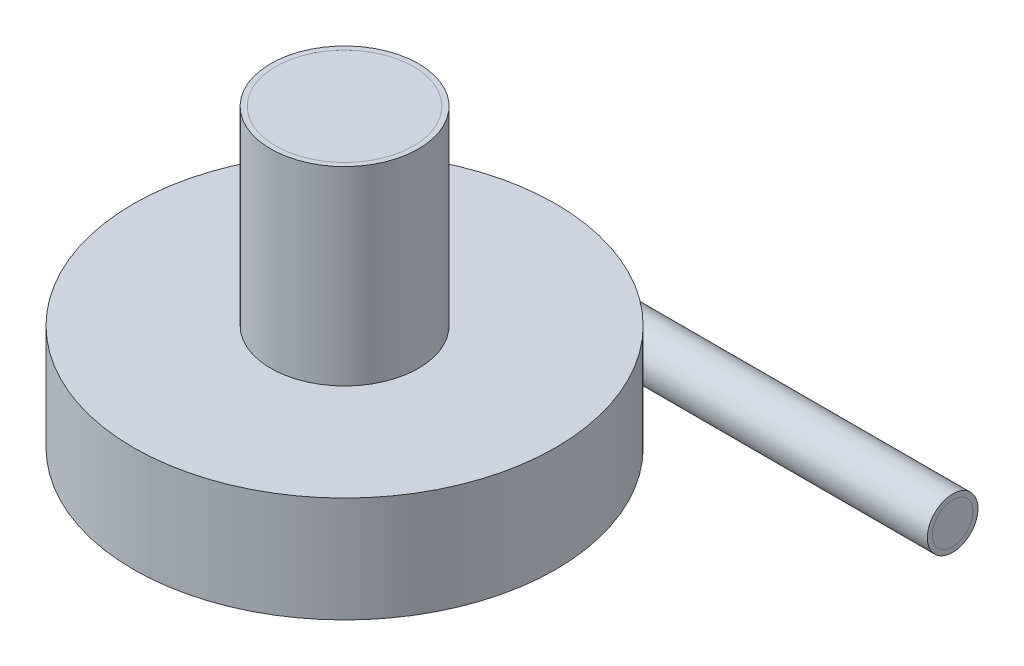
SolidWorks part; units mm, degrees
ref_plane "Front Plane" through (0, 0, 0) normal (0, 0, 1) x (1, 0, 0)
ref_plane "Top Plane" through (0, 0, 0) normal (0, 1, 0) x (1, 0, 0)
ref_plane "Right Plane" through (0, 0, 0) normal (1, 0, 0) x (0, 0, -1)
sketch "Sketch1" plane through (0, 0, 0) normal (0, 1, 0) x (1, 0, 0)
  line L0 (0, -40) -> (-4, -40)
  line L1 (-34.641, -20) -> (-36.641, -16.5359)
  line L2 (-34.641, 20) -> (-32.641, 23.4641)
  line L3 (0, 40) -> (4, 40)
  line L4 (34.641, 20) -> (36.641, 16.5359)
  line L5 (34.641, -20) -> (32.641, -23.4641)
  arc A0 (6.4713, -21.5493) -> (21.2246, -7.4678) centre (0, 0) ccw
  arc A1 (6.4713, -21.5493) -> (0, -40) centre (-13.2288, -25) cw
  arc A2 (4.145, -22.1149) -> (-4, -40) centre (-13.2288, -25) cw
  arc A3 (-17.0796, -14.6471) -> (-36.641, -16.5359) centre (-28.265, -1.0436) cw
  arc A4 (-15.4266, -16.379) -> (-34.641, -20) centre (-28.265, -1.0436) cw
  arc A5 (-21.2246, 7.4678) -> (-32.641, 23.4641) centre (-15.0363, 23.9564) cw
  arc A6 (-21.8979, 5.1703) -> (-34.641, 20) centre (-15.0363, 23.9564) cw
  arc A7 (-4.145, 22.1149) -> (4, 40) centre (13.2288, 25) cw
  arc A8 (-6.4713, 21.5493) -> (0, 40) centre (13.2288, 25) cw
  arc A9 (17.0796, 14.6471) -> (36.641, 16.5359) centre (28.265, 1.0436) cw
  arc A10 (15.4266, 16.379) -> (34.641, 20) centre (28.265, 1.0436) cw
  arc A11 (21.2246, -7.4678) -> (32.641, -23.4641) centre (15.0363, -23.9564) cw
  arc A12 (21.8979, -5.1703) -> (34.641, -20) centre (15.0363, -23.9564) cw
  arc A13 (-15.4266, -16.379) -> (4.145, -22.1149) centre (0, 0) ccw
  arc A14 (-21.8979, 5.1703) -> (-17.0796, -14.6471) centre (0, 0) ccw
  arc A15 (-6.4713, 21.5493) -> (-21.2246, 7.4678) centre (0, 0) ccw
  arc A16 (15.4266, 16.379) -> (-4.145, 22.1149) centre (0, 0) ccw
  arc A17 (21.8979, -5.1703) -> (17.0796, 14.6471) centre (0, 0) ccw
  point P6 (-2, -40)
  point P41 (0, 0)
  dimension "D1" = 45
  dimension "D3" = 20
  dimension "D2" = 4
  dimension "D4" = 40
  dimension "D5" = 6
extrude "Boss-Extrude1" add sketch "Sketch1" along normal mid plane 12
sketch "Sketch2" plane through (0, 0, 0) normal (0, 1, 0) x (1, 0, 0)
  circle A0 centre (0, 0) radius 50
  dimension "D1" = 100
extrude "Boss-Extrude2" add sketch "Sketch2" along normal mid plane 25 separate body
sketch "Sketch3" plane through (0, 12.5, 0) normal (0, 1, 0) x (1, 0, 0)
  circle A0 centre (0, 0) radius 17.5
  dimension "D1" = 35
extrude "Boss-Extrude3" add sketch "Sketch3" along normal blind 45
ref_plane "Plane1" through (100, 0, 0) normal (1, 0, 0) x (0, 0, -1)
sketch "Sketch5" plane through (100, 0, 0) normal (1, 0, 0) x (0, 0, -1)
  line L0 (50, 12.5) -> (-50, 12.5) construction
  circle A0 centre (44, 0) radius 6
  dimension "D3" = 12
  dimension "D1" = 12.5
  dimension "D2" = 6
extrude "Boss-Extrude4" add sketch "Sketch5" against normal up to body
shell "Shell1" thickness 1.2
sketch "Sketch6" plane through (0, 0, 0) normal (0, 1, 0) x (1, 0, 0)
  circle A0 centre (0, 0) radius 45
  dimension "D1" = 90
extrude "Boss-Extrude5" add sketch "Sketch6" along normal mid plane 17 separate body
imported_body "Lid1"
imported_body "Lid2"
